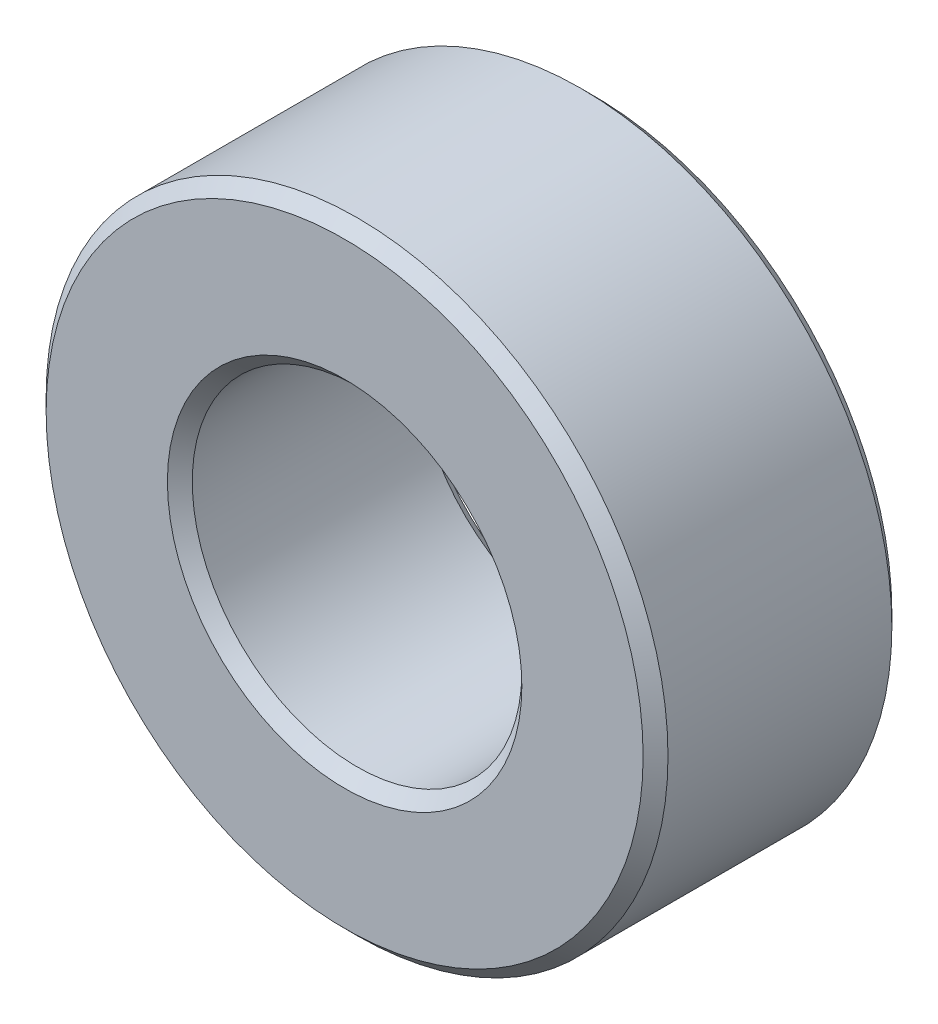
SolidWorks part; units mm, degrees
ref_plane "Front Plane" through (0, 0, 0) normal (0, 0, 1) x (1, 0, 0)
ref_plane "Top Plane" through (0, 0, 0) normal (0, 1, 0) x (1, 0, 0)
ref_plane "Right Plane" through (0, 0, 0) normal (1, 0, 0) x (0, 0, -1)
sketch "Sketch1" plane through (0, 0, 0) normal (0, 0, 1) x (1, 0, 0)
  circle A0 centre (0, 0) radius 5
  circle A1 centre (0, 0) radius 2.65
  dimension "D1" = 10
  dimension "D2" = 5.3
extrude "Boss-Extrude2" add sketch "Sketch1" along normal mid plane 4
chamfer "Chamfer3" distance 0.2 angle 45 4 edges at (5, 0, 2) (5, 0, -2) (2.65, 0, -2) (2.65, 0, 2)
